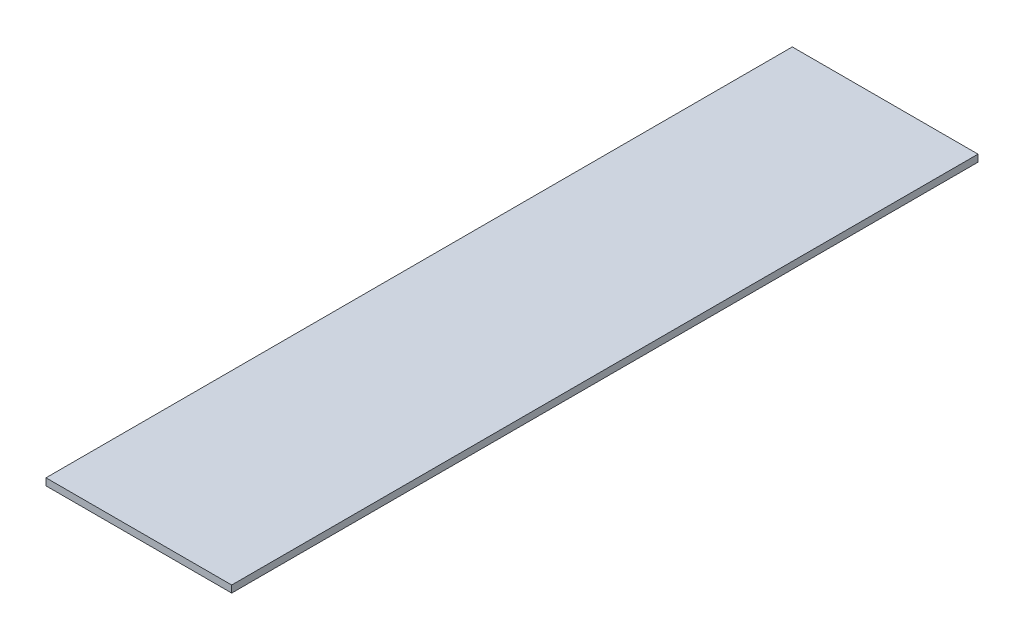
SolidWorks part; units mm, degrees
ref_plane "Front Plane" through (0, 0, 0) normal (0, 0, 1) x (1, 0, 0)
ref_plane "Top Plane" through (0, 0, 0) normal (0, 1, 0) x (1, 0, 0)
ref_plane "Right Plane" through (0, 0, 0) normal (1, 0, 0) x (0, 0, -1)
sketch "Sketch1" plane through (0, 0, 0) normal (0, 0, 1) x (1, 0, 0)
  line L1 (-265, -10) -> (265, -10)
  line L2 (-265, -10) -> (-265, 10)
  line L3 (-265, 10) -> (265, 10)
  line L4 (265, -10) -> (265, 10)
  line L5 (-265, -10) -> (265, 10) construction
  line L6 (-265, 10) -> (265, -10) construction
  point P0 (0, 0)
  dimension "D1" = 530
  dimension "D2" = 20
extrude "Boss-Extrude1" add sketch "Sketch1" along normal mid plane 2130
